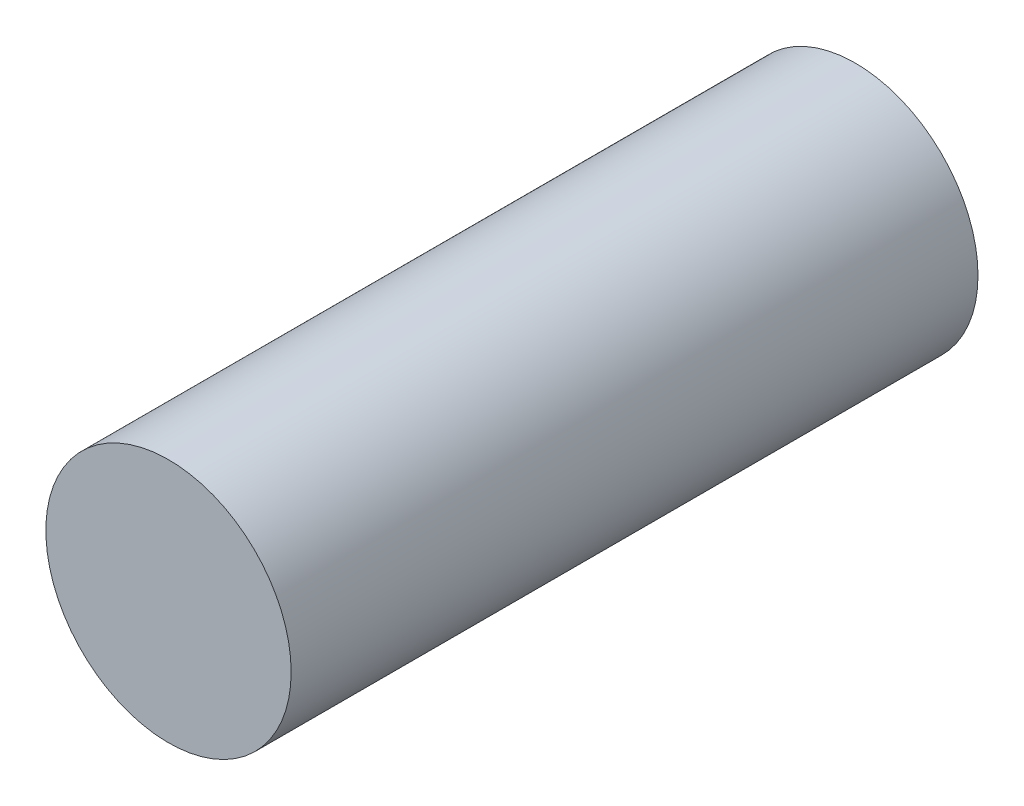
SolidWorks part; units mm, degrees
ref_plane "Plan de face" through (0, 0, 0) normal (0, 0, 1) x (1, 0, 0)
ref_plane "Plan de dessus" through (0, 0, 0) normal (0, 1, 0) x (1, 0, 0)
ref_plane "Plan de droite" through (0, 0, 0) normal (1, 0, 0) x (0, 0, -1)
sketch "Esquisse1" plane through (0, 0, 0) normal (0, 0, 1) x (1, 0, 0)
  circle A0 centre (-26.1172, 26.9099) radius 1.25 construction
  circle A1 centre (-26.1172, 26.9099) radius 1.25
extrude "Extrusion1" add sketch "Esquisse1" against normal offset from surface 2
